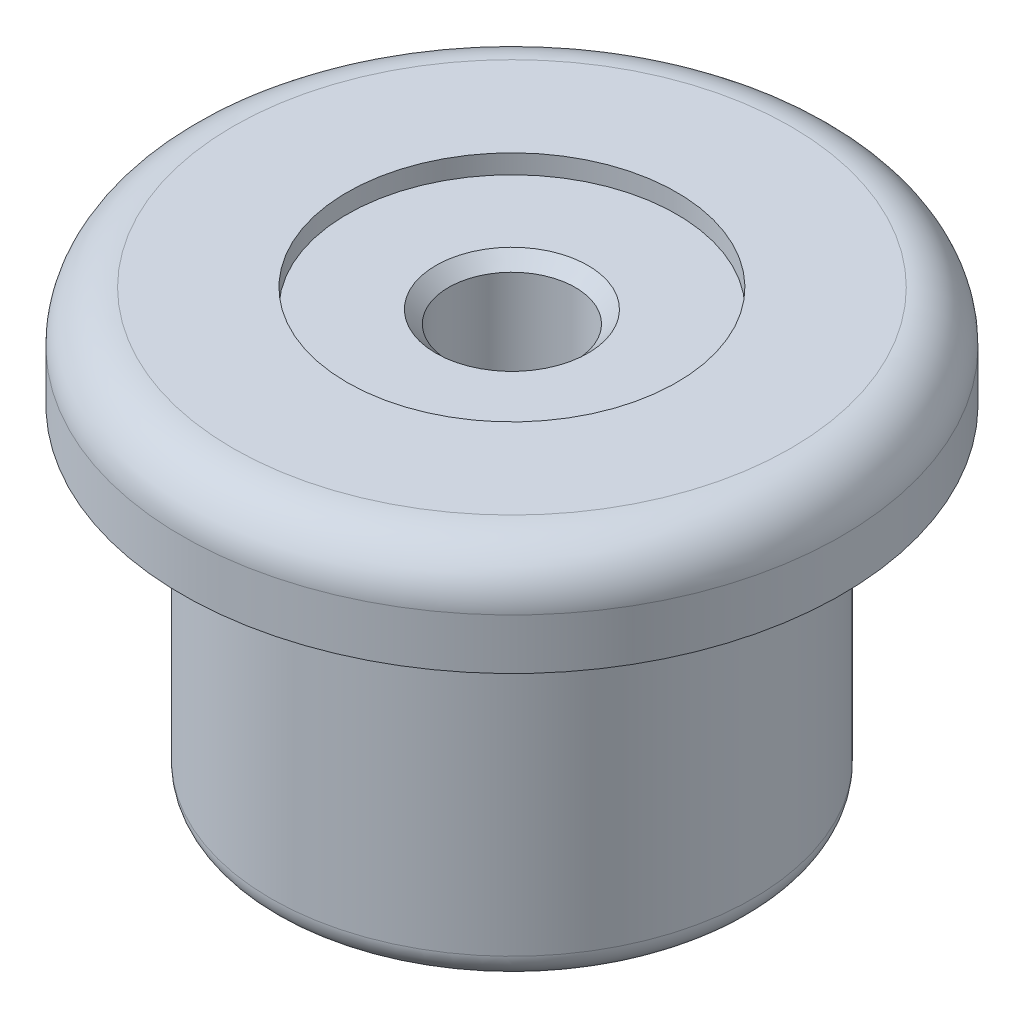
SolidWorks part; units mm, degrees
ref_plane "Front Plane" through (0, 0, 0) normal (0, 0, 1) x (1, 0, 0)
ref_plane "Top Plane" through (0, 0, 0) normal (0, 1, 0) x (1, 0, 0)
ref_plane "Right Plane" through (0, 0, 0) normal (1, 0, 0) x (0, 0, -1)
sketch "Sketch1" plane through (0, 0, 0) normal (0, 0, 1) x (1, 0, 0)
  line L0 (0, 0) -> (0, 19.9537) construction
  line L1 (9, 1.4) -> (9, 0)
  line L2 (9, 0) -> (9.5, 0)
  line L3 (9.5, 0) -> (9.5, 13)
  line L4 (9.5, 13) -> (13, 13)
  line L5 (13, 13) -> (13, 15)
  line L6 (11, 17) -> (0, 17)
  line L7 (0, 17) -> (0, 10.4)
  arc A0 (0, 10.4) -> (9, 1.4) centre (0, 1.4) cw
  arc A1 (13, 15) -> (11, 17) centre (11, 15) ccw
  dimension "D3" = 9
  dimension "D5" = 2
  dimension "D1" = 26
  dimension "D2" = 17
  dimension "D4" = 4
  dimension "D6" = 19
  dimension "D7" = 1.4
revolve "Revolve1" add sketch "Sketch1" angle 360 about L0
sketch "Sketch2" plane through (0, 17, 0) normal (0, 1, 0) x (-1, 0, 0)
  circle A0 centre (0, 0) radius 6.5
  dimension "D1" = 13
extrude "Cut-Extrude1" cut sketch "Sketch2" against normal blind 0.75
sketch "Sketch3" plane through (0, 16.25, 0) normal (0, 1, 0) x (-1, 0, 0)
  circle A0 centre (0, 0) radius 2.5
  dimension "D1" = 5
extrude "Cut-Extrude2" cut sketch "Sketch3" against normal through all
ref_plane "Plane2" through (0, -8, 0) normal (0, 1, 0) x (-1, 0, 0)
sketch "Sketch4" plane through (0, -8, 0) normal (0, 1, 0) x (-1, 0, 0)
  circle A0 centre (0, 0) radius 3
  dimension "D1" = 6
extrude "Cut-Extrude3" cut sketch "Sketch4" along normal blind 19
fillet "Fillet1" radius 1 1 edges at (0, 0, -9.5)
chamfer "Chamfer1" distance 0.5 angle 45 2 edges at (0, 16.25, 2.5) (0, 11, 2.5)
